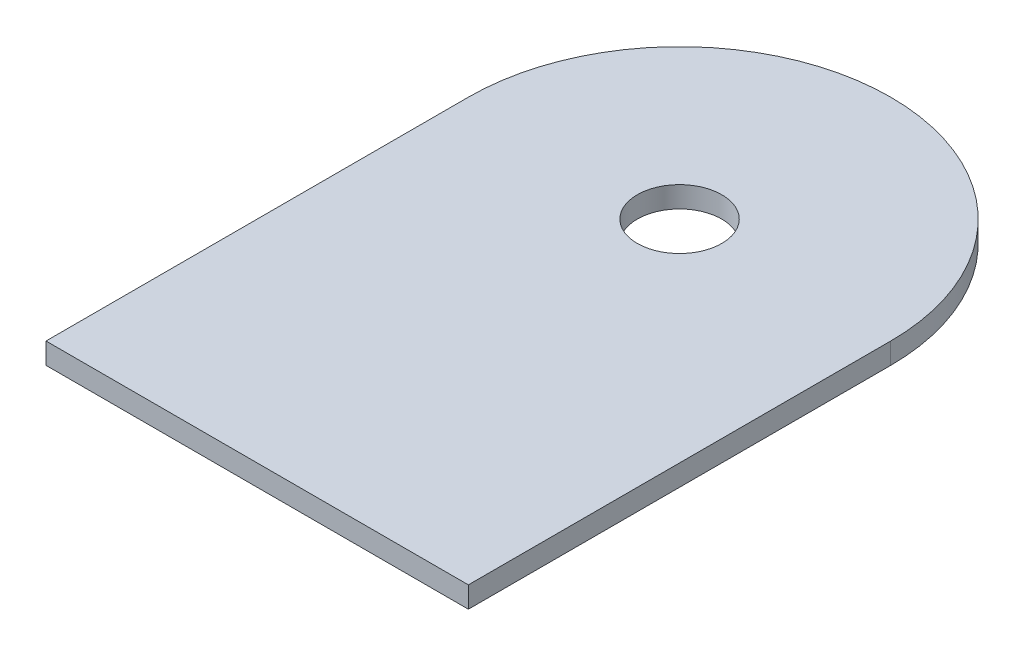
SolidWorks part; units mm, degrees
ref_plane "Front Plane" through (0, 0, 0) normal (0, 0, 1) x (1, 0, 0)
ref_plane "Top Plane" through (0, 0, 0) normal (0, 1, 0) x (1, 0, 0)
ref_plane "Right Plane" through (0, 0, 0) normal (1, 0, 0) x (0, 0, -1)
sketch "Sketch2" plane through (0, 0, 0) normal (0, 1, 0) x (1, 0, 0)
  line L0 (-43.75, 0) -> (43.75, 0) construction
  line L1 (20, 0) -> (20, -40)
  line L2 (20, -40) -> (-20, -40)
  line L4 (-20, 0) -> (-20, -40)
  circle A0 centre (0, 0) radius 4
  arc A1 (20, 0) -> (-20, 0) centre (0, 0) ccw
  point P7 (0, 0)
  dimension "D1" = 8
  dimension "D2" = 20
  dimension "D3" = 40
extrude "Boss-Extrude1" add sketch "Sketch2" along normal blind 2
